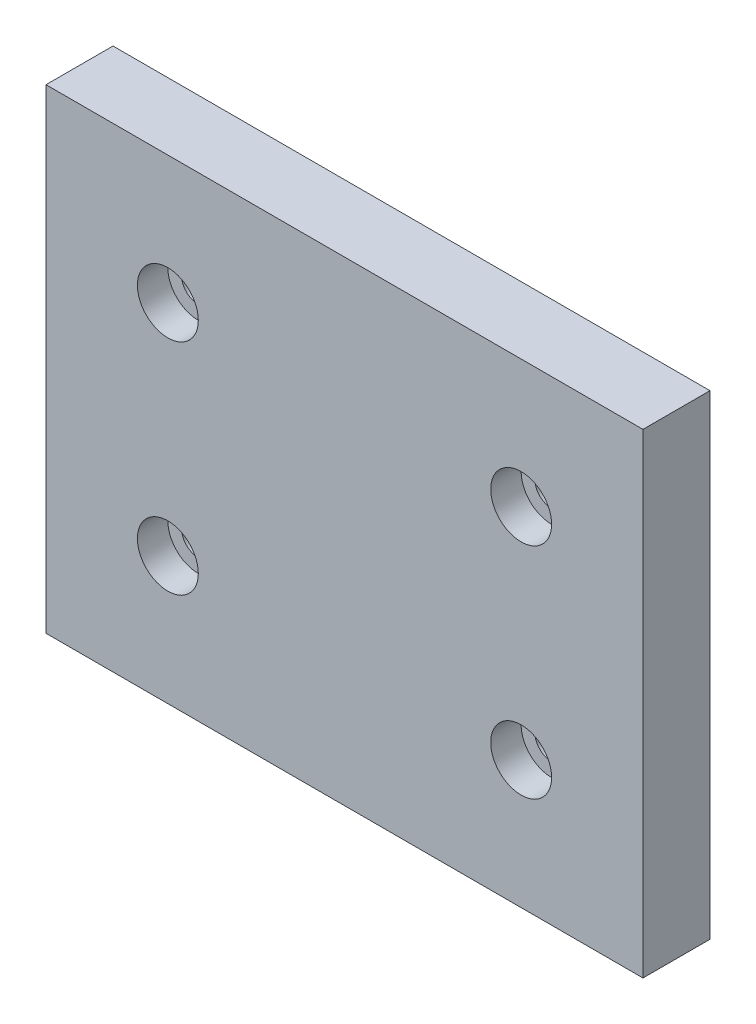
SolidWorks part; units mm, degrees
ref_plane "Face" through (0, 0, 0) normal (0, 0, 1) x (1, 0, 0)
ref_plane "Dessus" through (0, 0, 0) normal (0, 1, 0) x (1, 0, 0)
ref_plane "Droite" through (0, 0, 0) normal (1, 0, 0) x (0, 0, -1)
sketch "Esquisse1" plane through (0, 0, 0) normal (0, 0, 1) x (1, 0, 0)
  line L0 (0, 18.8207) -> (0, -16.8804) construction
  line L1 (-49, 39) -> (49, 39)
  line L2 (-49, 39) -> (-49, -39)
  line L3 (-49, -39) -> (49, -39)
  line L4 (49, 39) -> (49, -39)
  line L5 (-22.8953, 0) -> (26.3878, 0) construction
  dimension "D1" = 98
  dimension "D2" = 78
extrude "Extrusion1" add sketch "Esquisse1" along normal blind 11
hole_wizard "Chambrage pour vis à tête cylindrique à 6 pans creux (vis CHC) M51" positions "Esquisse4" profile "Esquisse3" counterbore size "M5" standard "ISO"
sketch "Esquisse4" plane through (0, 0, 11) normal (0, 0, 1) x (1, 0, 0)
  line L0 (-11.3715, 0) -> (9.8137, 0) construction
  line L1 (0, 10.0474) -> (0, -8.8012) construction
  point P0 (-29, 18)
  point P1 (29, 18)
  point P2 (29, -18)
  point P3 (-29, -18)
  dimension "D1" = 36
  dimension "D2" = 58
sketch "Esquisse3" plane through (-29, 18, 11) normal (1, 0, 0) x (0, -1, 0)
  line L0 (0, 0) -> (0, 11)
  line L1 (0, 11) -> (2.75, 11)
  line L3 (2.75, 11) -> (2.75, 5)
  line L4 (2.75, 5) -> (5, 5)
  line L5 (5, 5) -> (5, 0)
  line L7 (5, 0) -> (0, 0)
  line L11 (0, -6.35) -> (0, 107.95) construction
  dimension "Diamètre du perçage jusqu'au prochain" = 5.5
  dimension "Profondeur du perçage jusqu'au prochain" = 11
  dimension "Diamètre du chambrage" = 10
  dimension "Profondeur du chambrage" = 5
